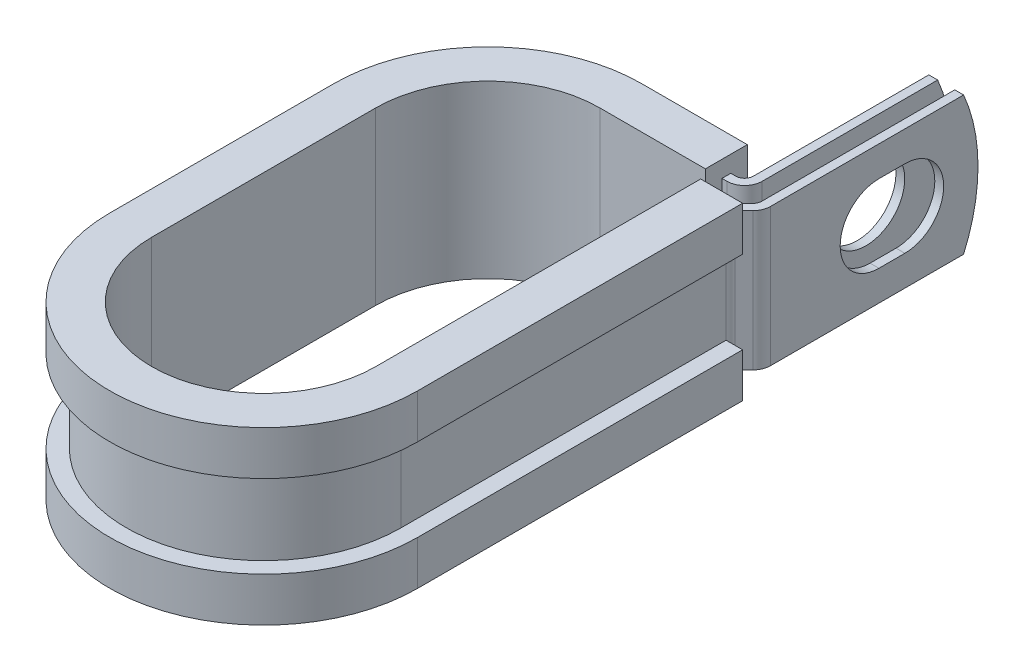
SolidWorks part; units mm, degrees
ref_plane "Front Plane" through (0, 0, 0) normal (0, 0, 1) x (1, 0, 0)
ref_plane "Top Plane" through (0, 0, 0) normal (0, 1, 0) x (1, 0, 0)
ref_plane "Right Plane" through (0, 0, 0) normal (1, 0, 0) x (0, 0, -1)
sketch "Sketch1" plane through (0, 0, 0) normal (0, 1, 0) x (1, 0, 0)
  line L0 (0, 11.8364) -> (10.1764, 11.8364)
  line L1 (11.8364, 0) -> (11.8364, 9.286)
  line L2 (11.802, 30.9372) -> (11.802, 13.462)
  line L3 (12.3125, 10.4355) -> (13.1387, 11.2617)
  line L4 (-11.8364, 0) -> (-11.8364, -20.6248)
  line L5 (13.3768, 11.8364) -> (13.3768, 30.9372)
  line L6 (11.8364, 0) -> (11.8364, -20.6248)
  arc A0 (0, 11.8364) -> (-11.8364, 0) centre (0, 0) ccw
  arc A1 (12.3125, 10.4355) -> (11.8364, 9.286) centre (13.462, 9.286) ccw
  arc A2 (13.1387, 11.2617) -> (13.3768, 11.8364) centre (12.564, 11.8364) ccw
  arc A3 (10.1764, 11.8364) -> (11.802, 13.462) centre (10.1764, 13.462) ccw
  arc A4 (-11.8364, -20.6248) -> (11.8364, -20.6248) centre (0, -20.6248) ccw
extrude "Extrude-Thin1" add sketch "Sketch1" along normal mid plane 12.7 thin
sketch "Sketch2" plane through (10.9892, 0, 0) normal (-1, 0, 0) x (0, 0, 1)
  line L0 (-30.9372, 6.35) -> (-30.9372, -6.35) construction
  line L1 (0, 6.35) -> (0, -6.35) construction
  circle A0 centre (-23.0124, 0) radius 3.5687
  point P2 (-30.9372, 0)
extrude "Cut-Extrude1" cut sketch "Sketch2" against normal up to surface (0.8128 mm away)
sketch "Sketch3" plane through (14.1896, 0, 0) normal (1, 0, 0) x (0, 0, -1)
  line L0 (21.8186, 0) -> (24.2062, 0) construction
  line L1 (21.8186, 3.5687) -> (24.2062, 3.5687)
  line L2 (21.8186, -3.5687) -> (24.2062, -3.5687)
  line L3 (30.9372, 6.35) -> (30.9372, -6.35) construction
  arc A0 (21.8186, 3.5687) -> (21.8186, -3.5687) centre (21.8186, 0) ccw
  arc A1 (24.2062, -3.5687) -> (24.2062, 3.5687) centre (24.2062, 0) ccw
  point P3 (23.0124, 0)
  point P8 (30.9372, 0)
  point P11 (18.2499, 0)
  point P12 (27.7749, 0)
extrude "Cut-Extrude2" cut sketch "Sketch3" against normal up to surface (0.8128 mm away)
sketch "Sketch4" plane through (10.9892, 0, 0) normal (-1, 0, 0) x (0, 0, 1)
  line L0 (-30.9372, 6.35) -> (-30.9372, -6.35)
  line L1 (-30.9372, 6.35) -> (-29.6119, 6.35)
  line L2 (-30.9372, 6.35) -> (-13.462, 6.35) construction
  line L3 (-30.9372, -6.35) -> (-29.6119, -6.35)
  line L4 (-30.9372, -6.35) -> (-13.462, -6.35) construction
  arc A0 (-29.6119, 6.35) -> (-29.6119, -6.35) centre (-15.0622, 0) ccw
extrude "Cut-Extrude3" cut sketch "Sketch4" against normal through all contours A0 M4 M5 | A0 L0 M2
ref_plane "Plane1" through (0, 0, -9.286) normal (0, 0, -1) x (-1, 0, 0)
ref_plane "Plane2" through (9.7192, 0, 0) normal (-1, 0, 0) x (0, 0, 1)
sketch "Sketch5" plane through (0, 0, -9.286) normal (0, 0, -1) x (-1, 0, 0)
  line L0 (-12.6492, 6.35) -> (-11.8364, 6.35)
  line L1 (-12.6492, 6.35) -> (-12.6492, -6.35) construction
  line L3 (-11.8364, 6.35) -> (-11.8364, -6.35)
  line L4 (-11.8364, -6.35) -> (-12.6492, -6.35)
  line L5 (-12.6492, -6.35) -> (-12.6492, -3.81)
  line L6 (-12.6492, 6.35) -> (-12.6492, 3.81)
  line L7 (-14.1732, 7.874) -> (-14.1732, 3.81)
  line L8 (-14.1732, 7.874) -> (-10.3124, 7.874)
  line L9 (-10.3124, 7.874) -> (-10.3124, -7.874)
  line L10 (-10.3124, -7.874) -> (-14.1732, -7.874)
  line L11 (-14.1732, -7.874) -> (-14.1732, -3.81)
  line L12 (-14.1732, 3.81) -> (-12.6492, 3.81)
  line L13 (-12.6492, -3.81) -> (-14.1732, -3.81)
sketch "Sketch6" plane through (0, 6.35, 0) normal (0, 1, 0) x (1, 0, 0)
  line L0 (10.3124, 0) -> (10.3124, 9.286)
  line L1 (10.3124, 9.286) -> (14.1732, 9.286) construction
  line L2 (9.7192, 6.9878) -> (9.7192, -6.9878) construction
  line L3 (10.3124, -20.6248) -> (10.3124, 0)
  line L4 (-10.3124, -20.6248) -> (-10.3124, 0)
  line L5 (0, 10.3124) -> (9.7192, 10.3124)
  arc A0 (0, 10.3124) -> (-10.3124, 0) centre (0, 0) ccw
  arc A1 (-10.3124, -20.6248) -> (10.3124, -20.6248) centre (0, -20.6248) ccw
sweep "Sweep1" add profiles "Sketch5" path "Sketch6"
equation "\"D4@Sketch5\" = \"D1@Extrude-Thin1\""
equation "\"D5@Sketch5\" = \"D5@Extrude-Thin1\""
equation "\"D1@Sketch3\" = \"D2@Sketch2\""
equation "\"D7@Sketch1\" = \"D3@Sketch2\" + \"D1@Sketch3\""
equation "\"D1@Sketch1\" = \"D1@Sketch6\" + 2 * \"D3@Sketch5\""
equation "\"D1@Sketch4\" = ( \"D1@Extrude-Thin1\" + .125 ) * 2"
equation "\"D9@Sketch1\"= \"D5@Extrude-Thin1\""
equation "\"D8@Sketch1\"= 2 * \"D5@Extrude-Thin1\""
equation "\"D2@Sketch1\" = 2 * \"D5@Extrude-Thin1\""
equation "\"D2@Sketch3\" = \"D1@Sketch2\""
equation "\"D6@Sketch1\" = \"D1@Sketch1\""
equation "\"D3@Sketch1\" = \"D1@Sketch6\""
